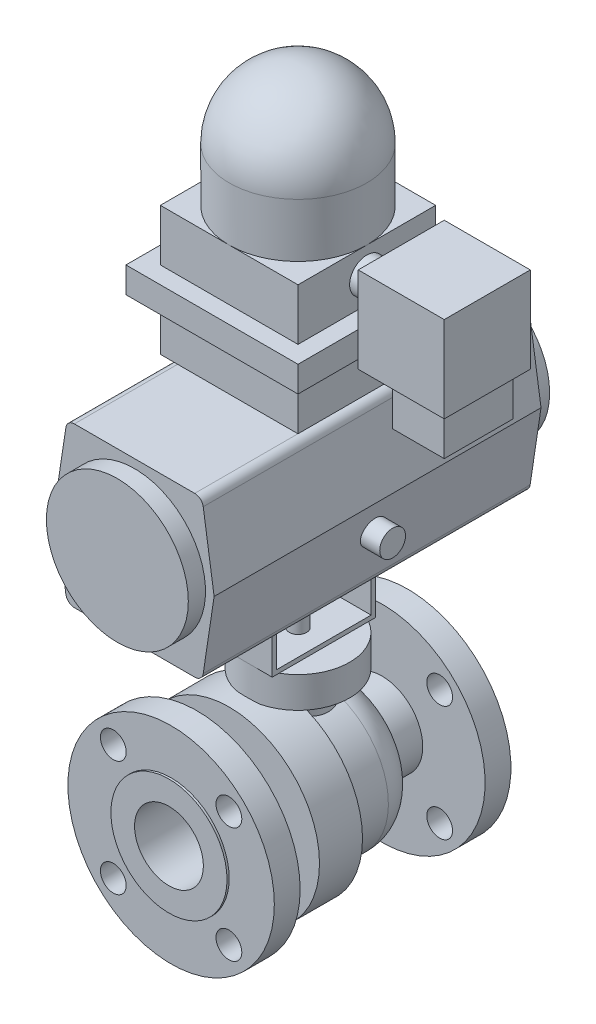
SolidWorks part; units mm, degrees
ref_plane "Front" through (0, 0, 0) normal (0, 0, 1) x (1, 0, 0)
ref_plane "Top" through (0, 0, 0) normal (0, 1, 0) x (1, 0, 0)
ref_plane "Right" through (0, 0, 0) normal (1, 0, 0) x (0, 0, -1)
sketch "Sketch1" plane through (0, 0, 0) normal (0, 0, 1) x (1, 0, 0)
  line L0 (0, 0) -> (72.0144, 0) construction
  line L1 (0, 0) -> (0, 97.5932) construction
  line L2 (-44.4089, 58.7375) -> (44.4089, 58.7375)
  line L3 (58.7375, 0) -> (50.6877, 53.3352)
  line L4 (-44.4089, -58.7375) -> (44.4089, -58.7375)
  line L5 (58.7375, 0) -> (50.6877, -53.3352)
  line L6 (-58.7375, 0) -> (-50.6877, 53.3352)
  line L7 (-58.7375, 0) -> (-50.6877, -53.3352)
  arc A0 (50.6877, -53.3352) -> (44.4089, -58.7375) centre (44.4089, -52.3875) cw
  arc A1 (50.6877, 53.3352) -> (44.4089, 58.7375) centre (44.4089, 52.3875) ccw
  arc A2 (-50.6877, 53.3352) -> (-44.4089, 58.7375) centre (-44.4089, 52.3875) cw
  arc A3 (-50.6877, -53.3352) -> (-44.4089, -58.7375) centre (-44.4089, -52.3875) ccw
  point P14 (0, 58.7375)
  point P20 (0, -58.7375)
  dimension "D2" = 12.7
  dimension "D7" = 6.35
  dimension "D3" = 58.7375
  dimension "D4" = 6.35
  dimension "D5" = 6.35
  dimension "D6" = 58.7375
  dimension "D8" = 53.3352
extrude "Base-Extrude" add sketch "Sketch1" along normal mid plane 241.3
sketch "Sketch4" plane through (0, 0, 0) normal (0, 0, 1) x (1, 0, 0)
  circle A0 centre (0, 0) radius 52.3875
  dimension "D1" = 104.775
extrude "Boss-Extrude2" add sketch "Sketch4" along normal mid plane 266.7
sketch "Sketch5" plane through (0, 58.7375, 0) normal (0, 1, 0) x (-1, 0, 0)
  circle A0 centre (0, 0) radius 25.4
  dimension "D1" = 50.8
extrude "Boss-Extrude3" add sketch "Sketch5" along normal blind 6.35
sketch "Sketch7" plane through (0, 65.0875, 0) normal (0, 1, 0) x (-1, 0, 0)
  line L0 (50.8, -50.8) -> (-50.8, -50.8)
  line L1 (-50.8, -50.8) -> (-50.8, 50.8)
  line L2 (50.8, 50.8) -> (-50.8, 50.8)
  line L3 (50.8, -50.8) -> (50.8, 50.8)
  dimension "D1" = 50.8
  dimension "D2" = 101.6
  dimension "D3" = 50.8
  dimension "D4" = 101.6
extrude "Boss-Extrude4" add sketch "Sketch7" along normal blind 38.1
sketch "Sketch8" plane through (0, 103.1875, 0) normal (0, 1, 0) x (-1, 0, 0)
  line L0 (63.5, -63.5) -> (-63.5, -63.5)
  line L1 (-63.5, -63.5) -> (-63.5, 63.5)
  line L2 (63.5, -63.5) -> (63.5, 63.5)
  line L3 (63.5, 63.5) -> (-63.5, 63.5)
  dimension "D1" = 63.5
  dimension "D2" = 127
  dimension "D3" = 63.5
  dimension "D4" = 127
extrude "Boss-Extrude5" add sketch "Sketch8" along normal blind 19.05
sketch "Sketch10" plane through (0, 122.2375, 0) normal (0, 1, 0) x (-1, 0, 0)
  line L0 (50.8, -50.8) -> (-50.8, -50.8)
  line L1 (50.8, -50.8) -> (50.8, 50.8)
  line L2 (50.8, 50.8) -> (-50.8, 50.8)
  line L3 (-50.8, 50.8) -> (-50.8, -50.8)
extrude "Boss-Extrude6" add sketch "Sketch10" along normal blind 38.1
sketch "Sketch12" plane through (0, 0, 0) normal (1, 0, 0) x (0, 0, -1)
  line L0 (0, 0) -> (0, 308.4017) construction
  line L1 (0, 65.0875) -> (0, 58.7375) construction
  line L2 (0, 250.825) -> (0, 160.3375)
  line L3 (50.8, 200.025) -> (50.8, 160.3375)
  line L4 (-50.8, 160.3375) -> (50.8, 160.3375) construction
  line L5 (0, 160.3375) -> (50.8, 160.3375)
  arc A0 (0, 250.825) -> (50.8, 200.025) centre (0, 200.025) cw
  dimension "D2" = 50.8
  dimension "D1" = 250.825
  dimension "D4" = 50.8
revolve "Boss-Revolve1" add sketch "Sketch12" angle 360 about L0
sketch "Sketch13" plane through (0, -58.7375, 0) normal (0, -1, 0) x (1, 0, 0)
  circle A0 centre (0, 0) radius 6.35
  dimension "D1" = 12.7
extrude "Boss-Extrude7" add sketch "Sketch13" along normal blind 147.32
sketch "Sketch14" plane through (50.8, 0, 0) normal (1, 0, 0) x (0, 0, -1)
  line L0 (0, 65.0875) -> (0, 58.7375) construction
  circle A0 centre (0, 141.2875) radius 12.7
  dimension "D1" = 25.4
  dimension "D2" = 50.8
  dimension "D3" = 76.2
extrude "Boss-Extrude8" add sketch "Sketch14" along normal blind 25.4
sketch "Sketch17" plane through (76.2, 0, 0) normal (1, 0, 0) x (0, 0, -1)
  line L0 (-31.75, 173.0375) -> (31.75, 173.0375)
  line L1 (-31.75, 173.0375) -> (-31.75, 109.5375)
  line L2 (31.75, 173.0375) -> (31.75, 109.5375)
  line L4 (-31.75, 109.5375) -> (31.75, 109.5375)
  dimension "D1" = 31.75
  dimension "D2" = 63.5
  dimension "D3" = 31.75
  dimension "D4" = 63.5
extrude "Boss-Extrude9" add sketch "Sketch17" along normal blind 63.5
sketch "Sketch18" plane through (0, 109.5375, 0) normal (0, -1, 0) x (1, 0, 0)
  line L0 (95.25, 25.4) -> (95.25, -25.4)
  line L1 (133.35, 25.4) -> (133.35, -25.4)
  line L2 (95.25, 25.4) -> (133.35, 25.4)
  line L3 (95.25, -25.4) -> (133.35, -25.4)
  dimension "D1" = 6.35
  dimension "D2" = 6.35
  dimension "D3" = 6.35
  dimension "D4" = 38.1
extrude "Boss-Extrude10" add sketch "Sketch18" along normal blind 31.75
sketch "Sketch19" plane through (0, 0, 0) normal (1, 0, 0) x (0, 0, -1)
  line L0 (133.35, -52.3875) -> (133.35, 52.3875) construction
  circle A0 centre (0, -20.6375) radius 9.525
  dimension "D1" = 19.05
  dimension "D2" = 133.35
  dimension "D3" = 38.1
extrude "Boss-Extrude11" add sketch "Sketch19" along normal blind 69.85
sketch "Sketch20" plane through (0, -58.7375, 0) normal (0, -1, 0) x (1, 0, 0)
  line L0 (-19.05, 38.1) -> (-19.05, -38.1)
  line L1 (-19.05, 38.1) -> (19.05, 38.1)
  line L2 (19.05, 38.1) -> (19.05, -38.1)
  line L3 (-19.05, -38.1) -> (19.05, -38.1)
  dimension "D1" = 19.05
  dimension "D2" = 38.1
  dimension "D3" = 38.1
  dimension "D4" = 76.2
extrude "Boss-Extrude12" add sketch "Sketch20" along normal blind 3.175
sketch "Sketch21" plane through (0, 0, 0) normal (1, 0, 0) x (0, 0, -1)
  line L2 (-97.3422, -182.5625) -> (321.0709, -182.5625) construction
  dimension "D1" = 120.65
sketch "Sketch22" plane through (0, 0, 0) normal (1, 0, 0) x (0, 0, -1)
  line L0 (12.7, -61.9125) -> (12.7, -65.0875)
  line L1 (38.1, -61.9125) -> (-38.1, -61.9125) construction
  line L2 (38.1, -61.9125) -> (38.1, -112.7125)
  line L3 (12.7, -61.9125) -> (38.1, -61.9125)
  line L4 (12.7, -65.0875) -> (34.925, -65.0875)
  line L5 (34.925, -65.0875) -> (34.925, -109.5375)
  line L6 (38.1, -112.7125) -> (-38.1, -112.7125)
  line L7 (34.925, -109.5375) -> (-34.925, -109.5375)
  line L9 (0, -21.1182) -> (0, -146.0816) construction
  line L10 (0, 65.0875) -> (0, 58.7375) construction
  line L11 (-34.925, -65.0875) -> (-34.925, -109.5375)
  line L12 (-38.1, -61.9125) -> (-38.1, -112.7125)
  line L13 (-12.7, -61.9125) -> (-38.1, -61.9125)
  line L14 (-12.7, -61.9125) -> (-12.7, -65.0875)
  line L15 (-12.7, -65.0875) -> (-34.925, -65.0875)
  dimension "D1" = 3.175
  dimension "D2" = 50.8
  dimension "D3" = 25.4
  dimension "D4" = 3.175
  dimension "D5" = 22.225
extrude "Boss-Extrude13" add sketch "Sketch22" along normal mid plane 38.1
ref_plane "Plane1" through (0, 0, 88.9) normal (0, 0, 1) x (1, 0, 0)
sketch "Sketch23" plane through (0, 0, 88.9) normal (0, 0, 1) x (1, 0, 0)
  line L0 (0, -109.5375) -> (0, -61.9125) construction
  circle A0 centre (0, -201.6125) radius 24.13
  dimension "D1" = 48.26
  dimension "D2" = 201.6125
ref_plane "Plane2" through (0, 0, 50.8) normal (0, 0, 1) x (1, 0, 0)
ref_plane "Plane5" through (0, -201.6125, 0) normal (0, 1, 0) x (-1, 0, 0)
ref_plane "Plane6" through (0, 0, 95.25) normal (0, 0, 1) x (1, 0, 0)
sketch "Sketch34" plane through (0, 0, 95.25) normal (0, 0, 1) x (1, 0, 0)
  line L0 (0, -109.5375) -> (0, -61.9125) construction
  line L1 (118.745, -201.6125) -> (-118.745, -201.6125) construction
  circle A0 centre (0, -201.6125) radius 30.1625
  dimension "D1" = 60.325
extrude "Boss-Extrude18" add sketch "Sketch34" against normal blind 177.8
sketch "Sketch35" plane through (0, 0, 95.25) normal (0, 0, 1) x (1, 0, 0)
  line L2 (0, -109.5375) -> (0, -61.9125) construction
  circle A0 centre (0, -201.6125) radius 42.8625
  circle A1 centre (0, -201.6125) radius 30.1625 construction
  dimension "D1" = 85.725
extrude "Boss-Extrude19" add sketch "Sketch35" against normal blind 1.5875
sketch "Sketch36" plane through (0, 0, 93.6625) normal (0, 0, -1) x (-1, 0, 0)
  line L0 (0, -109.5375) -> (0, -61.9125) construction
  circle A0 centre (0, -201.6125) radius 76.2
  circle A1 centre (0, -201.6125) radius 42.8625 construction
  dimension "D1" = 152.4
extrude "Boss-Extrude20" add sketch "Sketch36" along normal blind 19.05
sketch "Sketch37" plane through (0, 0, -82.55) normal (0, 0, -1) x (-1, 0, 0)
  line L0 (0, -109.5375) -> (0, -61.9125) construction
  circle A0 centre (0, -201.6125) radius 42.8625
  circle A1 centre (0, -201.6125) radius 76.2 construction
  dimension "D1" = 85.725
extrude "Boss-Extrude21" add sketch "Sketch37" against normal blind 1.5875
sketch "Sketch38" plane through (0, 0, -80.9625) normal (0, 0, 1) x (1, 0, 0)
  line L0 (0, -109.5375) -> (0, -61.9125) construction
  circle A0 centre (0, -201.6125) radius 76.2
  circle A1 centre (0, -201.6125) radius 42.8625 construction
  dimension "D1" = 152.4
extrude "Boss-Extrude22" add sketch "Sketch38" along normal blind 19.05
sketch "Sketch39" plane through (0, 0, -82.55) normal (0, 0, -1) x (-1, 0, 0)
  line L0 (0, -109.5375) -> (0, -61.9125) construction
  circle A0 centre (0, -201.6125) radius 25.4
  circle A1 centre (0, -201.6125) radius 42.8625 construction
  dimension "D1" = 50.8
extrude "Cut-Extrude1" cut sketch "Sketch39" against normal through all
sketch "Sketch40" plane through (0, 0, -80.9625) normal (0, 0, -1) x (-1, 0, 0)
  line L0 (-96.5363, -201.6125) -> (146.5173, -201.6125) construction
  line L1 (118.745, -201.6125) -> (-118.745, -201.6125) construction
  line L2 (0, -201.6125) -> (102.6276, -98.9849) construction
  circle A0 centre (42.6562, -158.9563) radius 9.525
  dimension "D2" = 19.05
  dimension "D1" = 45
  dimension "D3" = 60.325
extrude "Cut-Extrude2" cut sketch "Sketch40" against normal up to surface (19.05 mm away)
pattern_circular "CirPattern1" count 4 over 360 about axis through (0, -201.6125, 0) along (0, 0, 1) of "Cut-Extrude2"
sketch "Sketch41" plane through (0, 0, 93.6625) normal (0, 0, 1) x (1, 0, 0)
  line L0 (0, -201.6125) -> (78.9707, -122.6418) construction
  line L1 (118.745, -201.6125) -> (-118.745, -201.6125) construction
  circle A0 centre (42.6562, -158.9563) radius 9.525
  dimension "D2" = 19.05
  dimension "D1" = 45
  dimension "D3" = 60.325
extrude "Cut-Extrude3" cut sketch "Sketch41" against normal up to surface (19.05 mm away)
pattern_circular "CirPattern2" count 4 over 360 about axis through (0, -201.6125, 0) along (0, 0, 1) of "Cut-Extrude3"
ref_plane "Plane7" through (0, 0, 50.8) normal (0, 0, 1) x (1, 0, 0)
sketch "Sketch42" plane through (0, 0, 50.8) normal (0, 0, 1) x (1, 0, 0)
  line L0 (118.745, -201.6125) -> (-118.745, -201.6125) construction
  circle A0 centre (0, -201.6125) radius 66.675
  dimension "D1" = 133.35
extrude "Boss-Extrude23" add sketch "Sketch42" against normal blind 31.75
sketch "Sketch43" plane through (0, 0, 19.05) normal (0, 0, -1) x (-1, 0, 0)
  line L0 (118.745, -201.6125) -> (-118.745, -201.6125) construction
  circle A0 centre (0, -201.6125) radius 53.975
  dimension "D1" = 107.95
extrude "Boss-Extrude24" add sketch "Sketch43" along normal blind 57.15
fillet "Fillet2" radius 25.4 1 edges at (-53.975, -201.6125, -38.1)
sketch "Sketch44" plane through (0, -112.7125, 0) normal (0, -1, 0) x (1, 0, 0)
  circle A0 centre (0, 0) radius 38.1
  dimension "D1" = 76.2
extrude "Boss-Extrude25" add sketch "Sketch44" along normal blind 22.86
sketch "Sketch45" plane through (0, -135.5725, 0) normal (0, -1, 0) x (1, 0, 0)
  circle A0 centre (0, 0) radius 22.225
  dimension "D1" = 44.45
extrude "Boss-Extrude26" add sketch "Sketch45" along normal blind 22.86
sketch "Sketch46" plane through (0, 0, -82.55) normal (0, 0, -1) x (-1, 0, 0)
  line L0 (118.745, -201.6125) -> (-118.745, -201.6125) construction
  circle A0 centre (0, -201.6125) radius 25.4
  dimension "D1" = 50.8
extrude "Cut-Extrude4" cut sketch "Sketch46" against normal through all
sketch "Sketch47" plane through (0, 0, 93.6625) normal (0, 0, 1) x (1, 0, 0)
  circle A0 centre (0, -201.6125) radius 76.2 construction
  point P0 (0, -201.6125)
sketch "Sketch48" plane through (0, 0, -80.9625) normal (0, 0, -1) x (-1, 0, 0)
  circle A0 centre (0, -201.6125) radius 76.2 construction
  point P0 (0, -201.6125)
other "RPoint1"
other "RPoint2"
